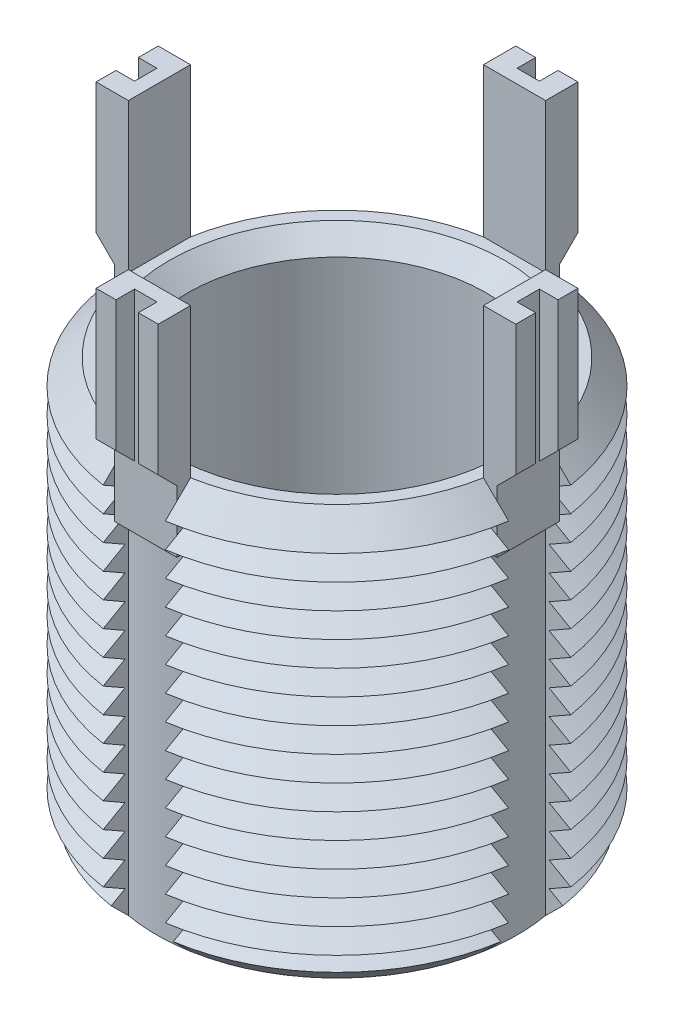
SolidWorks part; units mm, degrees
ref_plane "Front Plane" through (0, 0, 0) normal (0, 0, 1) x (1, 0, 0)
ref_plane "Top Plane" through (0, 0, 0) normal (0, 1, 0) x (1, 0, 0)
ref_plane "Right Plane" through (0, 0, 0) normal (1, 0, 0) x (0, 0, -1)
sketch "Sketch1" plane through (0, 0, 0) normal (0, 1, 0) x (1, 0, 0)
  circle A0 centre (0, 0) radius 16.5
  dimension "D1" = 33
extrude "Boss-Extrude1" add sketch "Sketch1" against normal blind 33
chamfer "Chamfer1" distance 2 angle 45 2 edges at (0, -33, 16.5) (0, 0, 16.5)
sketch "Sketch2" plane through (0, 0, 0) normal (1, 0, 0) x (0, 0, -1)
  line L0 (0, 0.8859) -> (0, -9.2617) construction
sketch "Sketch3" plane through (0, 0, 0) normal (1, 0, 0) x (0, 0, -1)
  line L0 (-16.5, -2) -> (-14.7679, -3)
  line L1 (-14.7679, -3) -> (-16.5, -4)
  line L2 (-16.5, -2) -> (-16.5, -31) construction
  line L3 (-16.5, -4) -> (-16.5, -2)
  dimension "D1" = 2
revolve "Cut-Revolve1" cut sketch "Sketch3" angle 360 about L0
pattern_linear "LPattern1" count 15 spacing 2 along (0, -1, 0) of "Cut-Revolve1"
sketch "Sketch4" plane through (0, 0, 0) normal (0, 1, 0) x (1, 0, 0)
  line L0 (-14.2829, 2.5) -> (-16.3095, 2.5)
  line L2 (-16.3095, -2.5) -> (-14.2829, -2.5)
  arc A0 (-14.2829, 2.5) -> (-14.2829, -2.5) centre (0, 0) ccw
  arc A1 (-16.3095, 2.5) -> (-16.3095, -2.5) centre (0, 0) ccw
  circle A2 centre (0, 0) radius 16.5 construction
  circle A3 centre (0, 0) radius 14.5 construction
  point P1 (-14.5, 0)
  point P3 (-16.5, 0)
  point P13 (0, 0)
  dimension "D1" = 5
extrude "Cut-Extrude1" cut sketch "Sketch4" against normal up to surface (33 mm away)
pattern_circular "CirPattern1" count 4 over 360 about axis through (0, 0, 0) along (0, 1, 0) of "Cut-Extrude1"
sketch "Sketch5" plane through (0, 0, 0) normal (1, 0, 0) x (0, 0, -1)
  line L0 (-14.2829, 12) -> (-14.2829, -5)
  line L1 (-14.2829, -5) -> (-15.3829, -5)
  line L2 (-15.3829, -5) -> (-15.3829, 0)
  line L3 (-15.3829, 0) -> (-16.8829, 1.5)
  line L4 (-16.8829, 1.5) -> (-16.8829, 12)
  line L5 (-16.8829, 12) -> (-14.2829, 12)
  line L6 (-16.3095, -6) -> (-2.5, -6) construction
  point P9 (-2.5, 0)
  point P10 (-15.3829, 0)
  dimension "D1" = 1
  dimension "D2" = 17
  dimension "D3" = 12
  dimension "D4" = 2.6
  dimension "D5" = 1.1
  dimension "D6" = 45
extrude "Boss-Extrude3" add sketch "Sketch5" along normal mid plane 5
pattern_circular "CirPattern2" count 4 over 360 about axis through (0, 0, 0) along (0, 1, 0) of "Boss-Extrude3"
sketch "Sketch6" plane through (0, 12, 0) normal (0, 1, 0) x (1, 0, 0)
  line L0 (-16.8829, -2.5) -> (-16.8829, 2.5) construction
  line L1 (-16.8829, -0.9) -> (-15.3829, -0.9)
  line L2 (-16.8829, -0.9) -> (-16.8829, 0.9)
  line L3 (-16.8829, 0.9) -> (-15.3829, 0.9)
  line L4 (-15.3829, -0.9) -> (-15.3829, 0.9)
  line L5 (-16.8829, -0.9) -> (-15.3829, 0.9) construction
  line L6 (-16.8829, 0.9) -> (-15.3829, -0.9) construction
  line L7 (16.8829, 2.5) -> (16.8829, -2.5) construction
  line L8 (-0.9, 15.3829) -> (0.9, 15.3829)
  line L9 (-0.9, 15.3829) -> (-0.9, 16.8829)
  line L10 (-0.9, 16.8829) -> (0.9, 16.8829)
  line L11 (0.9, 15.3829) -> (0.9, 16.8829)
  line L12 (-0.9, 15.3829) -> (0.9, 16.8829) construction
  line L13 (-0.9, 16.8829) -> (0.9, 15.3829) construction
  line L14 (15.3829, -0.9) -> (16.8829, -0.9)
  line L15 (15.3829, -0.9) -> (15.3829, 0.9)
  line L16 (15.3829, 0.9) -> (16.8829, 0.9)
  line L17 (16.8829, -0.9) -> (16.8829, 0.9)
  line L18 (15.3829, -0.9) -> (16.8829, 0.9) construction
  line L19 (15.3829, 0.9) -> (16.8829, -0.9) construction
  line L20 (-0.9, -16.8829) -> (0.9, -16.8829)
  line L21 (-0.9, -16.8829) -> (-0.9, -15.3829)
  line L22 (-0.9, -15.3829) -> (0.9, -15.3829)
  line L23 (0.9, -16.8829) -> (0.9, -15.3829)
  line L24 (-0.9, -16.8829) -> (0.9, -15.3829) construction
  line L25 (-0.9, -15.3829) -> (0.9, -16.8829) construction
  line L26 (-2.5, 16.8829) -> (2.5, 16.8829) construction
  line L27 (2.5, -16.8829) -> (-2.5, -16.8829) construction
  point P0 (-16.1329, 0)
  point P7 (-16.8829, 0)
  point P8 (-16.8829, 0)
  point P9 (0, 16.1329)
  point P14 (16.1329, 0)
  point P19 (0, -16.1329)
  point P24 (0, 16.8829)
  point P25 (16.8829, 0)
  point P26 (16.8829, 0)
  point P27 (0, 16.8829)
  point P30 (0, -16.8829)
  point P33 (0, -16.8829)
  dimension "D1" = 1.8
  dimension "D2" = 1.5
extrude "Cut-Extrude3" cut sketch "Sketch6" against normal through all both and the other way through all
sketch "Sketch7" plane through (0, 0, 0) normal (0, 1, 0) x (1, 0, 0)
  circle A0 centre (0, 0) radius 12
  dimension "D1" = 24
extrude "Cut-Extrude4" cut sketch "Sketch7" against normal up to surface (33 mm away)
chamfer "Chamfer2" distance 1.5 angle 45 2 edges at (0, 0, 12) (0, -33, 12)
